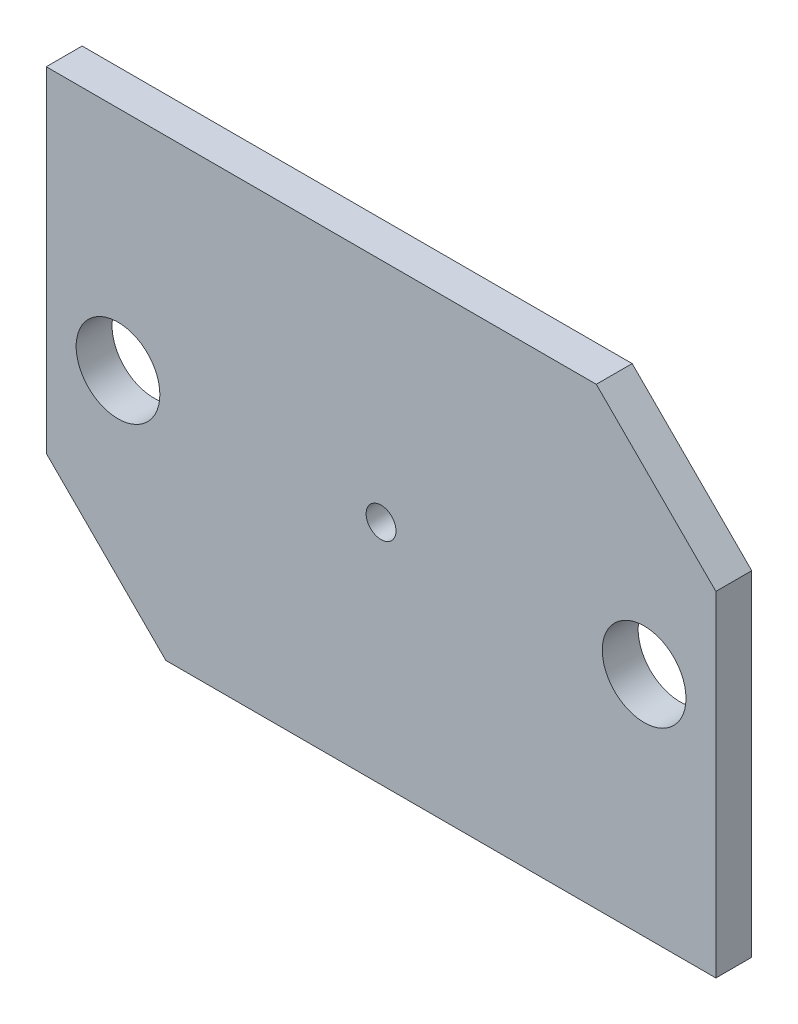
SolidWorks part; units mm, degrees
ref_plane "Plan1" through (0, 0, 0) normal (0, 0, 1) x (1, 0, 0)
ref_plane "Plan2" through (0, 0, 0) normal (0, 1, 0) x (1, 0, 0)
ref_plane "Plan3" through (0, 0, 0) normal (1, 0, 0) x (0, 0, -1)
sketch "Esquisse1" plane through (0, 0, 0) normal (0, 0, 1) x (1, 0, 0)
  line L0 (-50, -21) -> (6, -21) construction
  line L1 (-50, -40) -> (6, -40)
  line L2 (-50, -40) -> (-50, -2)
  line L3 (-50, -2) -> (6, -2)
  line L4 (6, -40) -> (6, -2)
  line L5 (-22, -2) -> (-22, -40) construction
  circle A0 centre (-22, -21) radius 1.25
  circle A1 centre (-44, -21) radius 3.5
  circle A2 centre (0, -21) radius 3.5
  dimension "D5" = 7
  dimension "D6" = 7
  dimension "D7" = 2.5
  dimension "D1" = 56
  dimension "D2" = 38
  dimension "D3" = 6
  dimension "D4" = 44
extrude "Base-Extrusion" add sketch "Esquisse1" along normal blind 3
chamfer "Chanfrein1" distance 10 angle 45 2 edges at (6, -2, 1.5) (-50, -40, 1.5)
